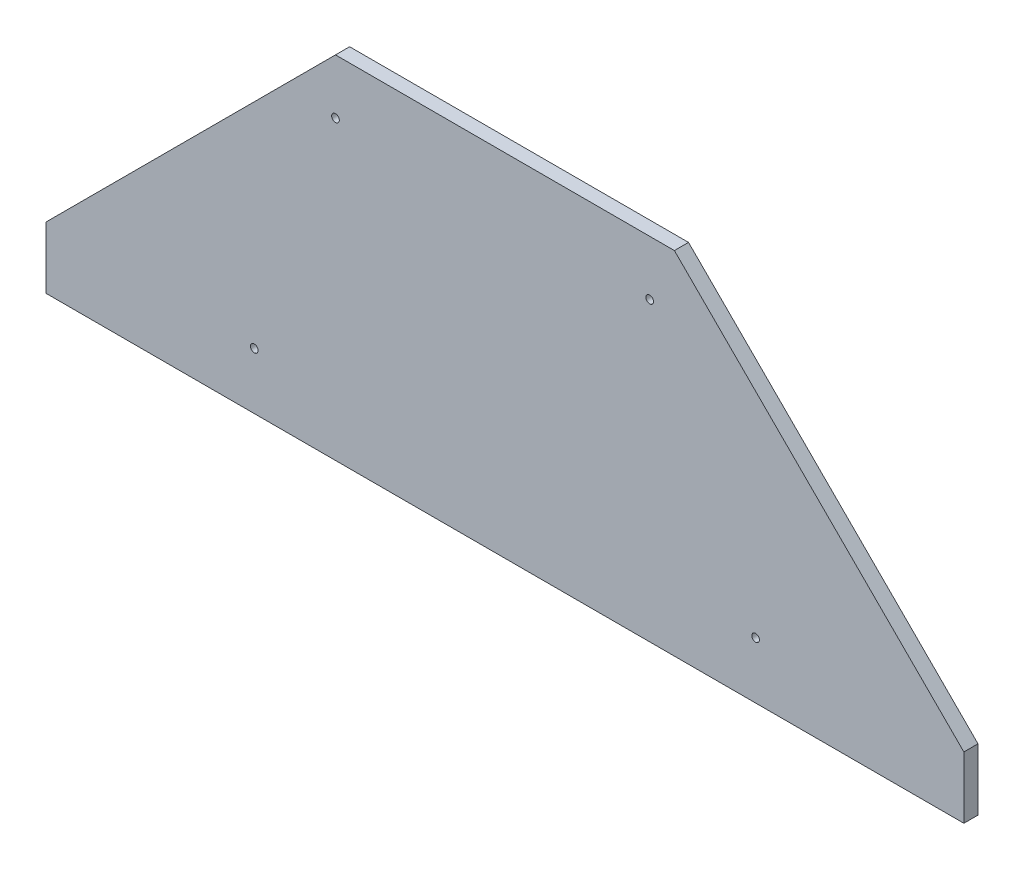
SolidWorks part; units mm, degrees
ref_plane "Front Plane" through (0, 0, 0) normal (0, 0, 1) x (1, 0, 0)
ref_plane "Top Plane" through (0, 0, 0) normal (0, 1, 0) x (1, 0, 0)
ref_plane "Right Plane" through (0, 0, 0) normal (1, 0, 0) x (0, 0, -1)
sketch "Sketch1" plane through (0, 0, 0) normal (0, 0, 1) x (1, 0, 0)
  line L0 (152.4, 157.9562) -> (412.75, -102.3937)
  line L1 (-412.75, -157.9562) -> (412.75, -157.9562)
  line L2 (-412.75, -157.9562) -> (-412.75, 157.9562)
  line L3 (-412.75, 157.9562) -> (412.75, 157.9562)
  line L4 (412.75, -157.9562) -> (412.75, 157.9562)
  line L5 (-412.75, -157.9562) -> (412.75, 157.9562) construction
  line L6 (-412.75, 157.9562) -> (412.75, -157.9562) construction
  line L7 (-152.4, 157.9562) -> (-412.75, -102.3937)
  line L8 (-179.5524, 108.7438) -> (175.2, 108.7438) construction
  line L9 (-289.8776, -107.1562) -> (301.6935, -107.1562) construction
  circle A0 centre (130.175, 108.7438) radius 3.429
  circle A1 centre (-152.4, 108.7438) radius 3.429
  circle A2 centre (-225.425, -107.1562) radius 3.429
  circle A3 centre (225.425, -107.1562) radius 3.429
  point P0 (0, 0)
  dimension "D9" = 6.858
  dimension "D10" = 282.575
  dimension "D11" = 187.325
  dimension "D12" = 638.175
  dimension "D13" = 565.15
  dimension "D1" = 315.9125
  dimension "D2" = 825.5
  dimension "D3" = 260.35
  dimension "D4" = 55.5625
  dimension "D5" = 565.15
  dimension "D6" = 55.5625
  dimension "D7" = 50.8
  dimension "D8" = 266.7
extrude "Extrude1" add sketch "Sketch1" along normal mid plane 12.7 contours L3 L7 L2 L1 L4 L0 A3 A2 A1 A0
